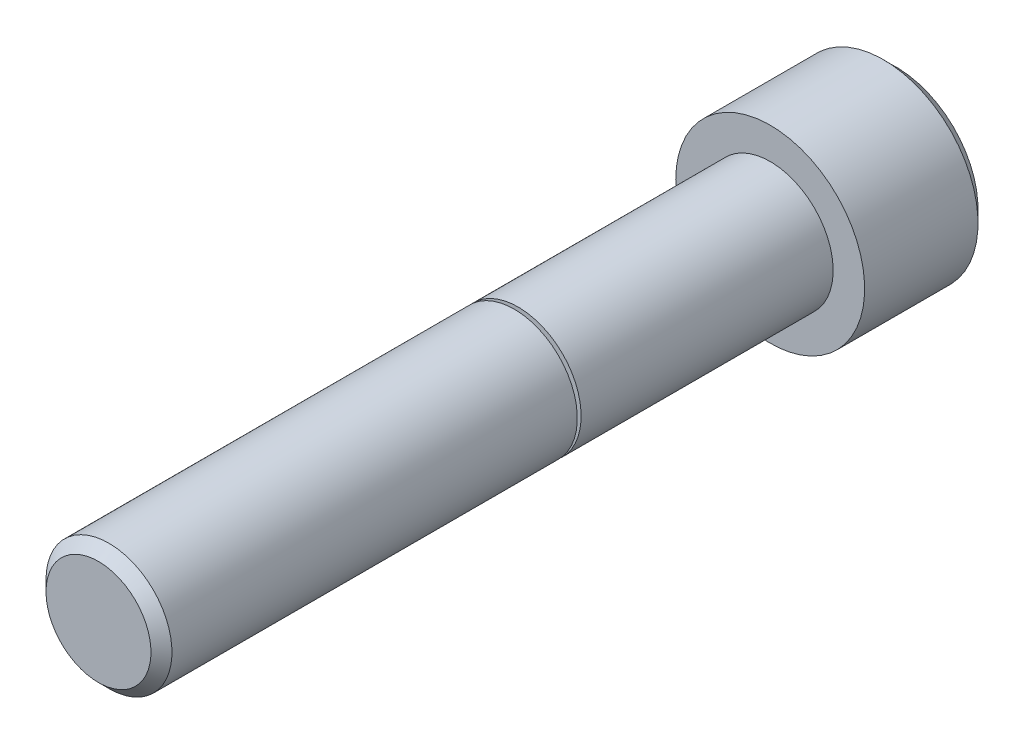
SolidWorks part; units mm, degrees
ref_plane "Front" through (0, 0, 0) normal (0, 0, 1) x (1, 0, 0)
ref_plane "Top" through (0, 0, 0) normal (0, 1, 0) x (1, 0, 0)
ref_plane "Right" through (0, 0, 0) normal (1, 0, 0) x (0, 0, -1)
sketch "Logo3_Revol_Axis" plane through (0, 0, 0) normal (0, 1, 0) x (1, 0, 0)
  line L0 (0, -43.5172) -> (0, 43.5172) construction
sketch "Logo3_bib1" plane through (0, 0, 0) normal (0, -1, 0) x (-1, 0, 0)
  line L0 (0, -50.8) -> (0, 9.525)
  line L1 (0, 9.525) -> (6.1913, 9.525)
  line L2 (7.1438, 8.5725) -> (7.1438, 0)
  line L3 (7.1438, 0) -> (4.7625, 0)
  line L4 (4.7625, 0) -> (4.7625, -19.06)
  line L5 (4.7625, -50.0063) -> (3.9688, -50.8)
  line L6 (3.9688, -50.8) -> (0, -50.8)
  line L7 (4.7625, -19.06) -> (4.0822, -19.06)
  line L8 (4.0753, -19.0988) -> (4.7625, -19.3489)
  line L9 (4.7625, -19.3489) -> (4.7625, -50.0063)
  line L10 (0, 10.5852) -> (0, -63.2873) construction
  line L11 (6.1913, 9.525) -> (7.1438, 8.5725)
  arc A1 (4.0822, -19.06) -> (4.0753, -19.0988) centre (4.0822, -19.08) ccw
  point P17 (3.9688, -19.06)
  point P19 (7.1438, 9.525)
revolve "Revolve1" add sketch "Logo3_bib1" angle 360 about L10
sketch "Logo3_bib2" plane through (0, 0, -9.525) normal (0, 0, -1) x (1, 0, 0)
  line L1 (4.5754, 0) -> (2.2877, 3.9624)
  line L2 (2.2877, 3.9624) -> (-2.2877, 3.9624)
  line L3 (-2.2877, 3.9624) -> (-4.5754, 0)
  line L4 (-4.5754, 0) -> (-2.2877, -3.9624)
  line L5 (-2.2877, -3.9624) -> (2.2877, -3.9624)
  line L6 (2.2877, -3.9624) -> (4.5754, 0)
  circle A0 centre (0, 0) radius 3.9624 construction
  dimension "Logo3_c1" = 7.9248
extrude "Cut-Extrude1" cut sketch "Logo3_bib2" against normal blind 4.7625
equation "\"DIA2@Logo3_bib1\" = \"Logo3_d1-pas@Logo3_bib1\""
equation "\"LGT1@Logo3_bib1\" = \"Logo3_d1@Logo3_bib1\""
equation "\"D1@Cut-Extrude1\" = \"Logo3_d1@Logo3_bib1\"/2."
equation "\"D2@Cosmetic Thread1\" = \"Logo3_d1-pas@Logo3_bib1\""
equation "\"D5@Logo3_bib1\"=\"Logo3_d1@Logo3_bib1\"*.1"
